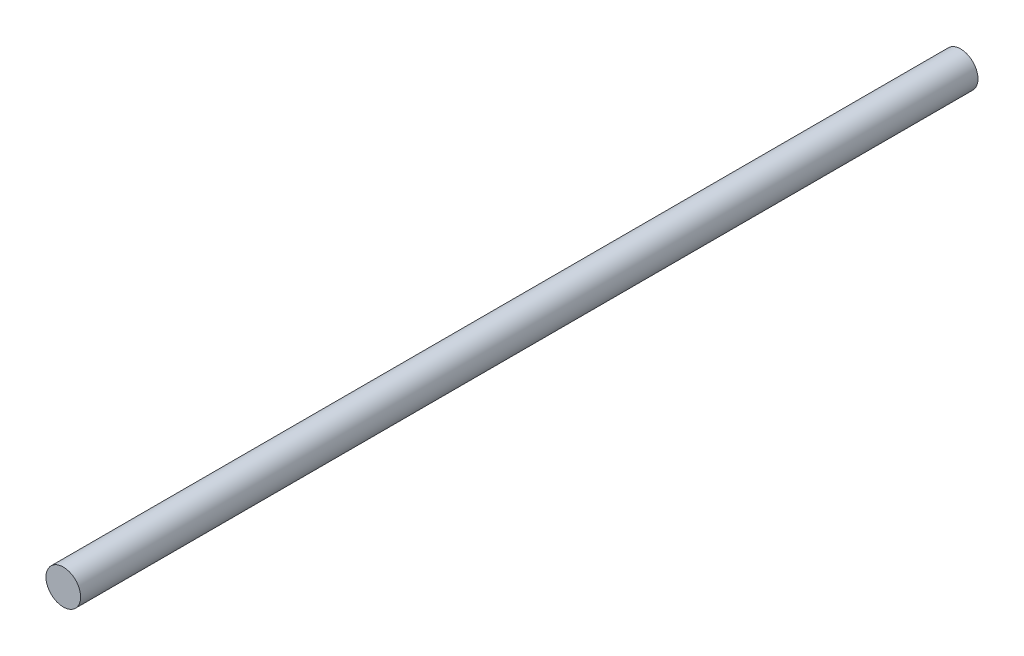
SolidWorks part; units mm, degrees
ref_plane "Front Plane" through (0, 0, 0) normal (0, 0, 1) x (1, 0, 0)
ref_plane "Top Plane" through (0, 0, 0) normal (0, 1, 0) x (1, 0, 0)
ref_plane "Right Plane" through (0, 0, 0) normal (1, 0, 0) x (0, 0, -1)
sketch "Sketch1" plane through (0, 0, 0) normal (0, 0, 1) x (1, 0, 0)
  circle A0 centre (0, 0) radius 8.001
extrude "Boss-Extrude1" add sketch "Sketch1" along normal blind 414.3375
